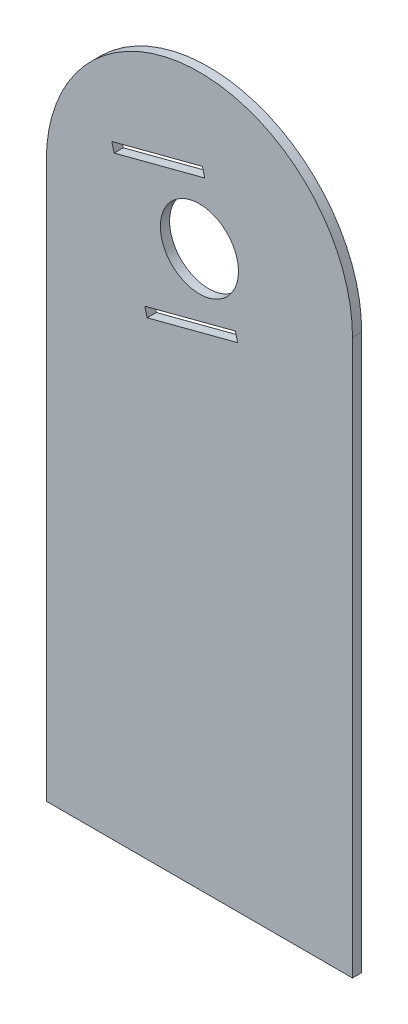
SolidWorks part; units mm, degrees
ref_plane "Front Plane" through (0, 0, 0) normal (0, 0, 1) x (1, 0, 0)
ref_plane "Top Plane" through (0, 0, 0) normal (0, 1, 0) x (1, 0, 0)
ref_plane "Right Plane" through (0, 0, 0) normal (1, 0, 0) x (0, 0, -1)
sketch "Sketch1" plane through (0, 0, 0) normal (0, 0, 1) x (1, 0, 0)
  line L0 (-34.0531, -35.0117) -> (-34.0531, -127.0741)
  line L1 (-34.0531, -127.0741) -> (-84.8531, -127.0741)
  line L2 (-84.8531, -35.0117) -> (-84.8531, -127.0741)
  line L3 (-73.9882, -26.8477) -> (-73.6023, -28.3221)
  line L4 (-73.6023, -28.3221) -> (-58.5723, -24.3877)
  line L5 (-58.5723, -24.3877) -> (-58.9582, -22.9134)
  line L6 (-58.9582, -22.9134) -> (-73.9882, -26.8477)
  line L7 (-53.094, -45.3158) -> (-53.4799, -43.8415)
  line L8 (-53.4799, -43.8415) -> (-68.5099, -47.7758)
  line L9 (-68.5099, -47.7758) -> (-68.124, -49.2502)
  line L10 (-68.124, -49.2502) -> (-53.094, -45.3158)
  circle A0 centre (-59.4531, -35.0117) radius 6.477
  arc A1 (-34.0531, -35.0117) -> (-84.8531, -35.0117) centre (-59.4531, -35.0117) ccw
extrude "Boss-Extrude1" add sketch "Sketch1" along normal blind 1.524
